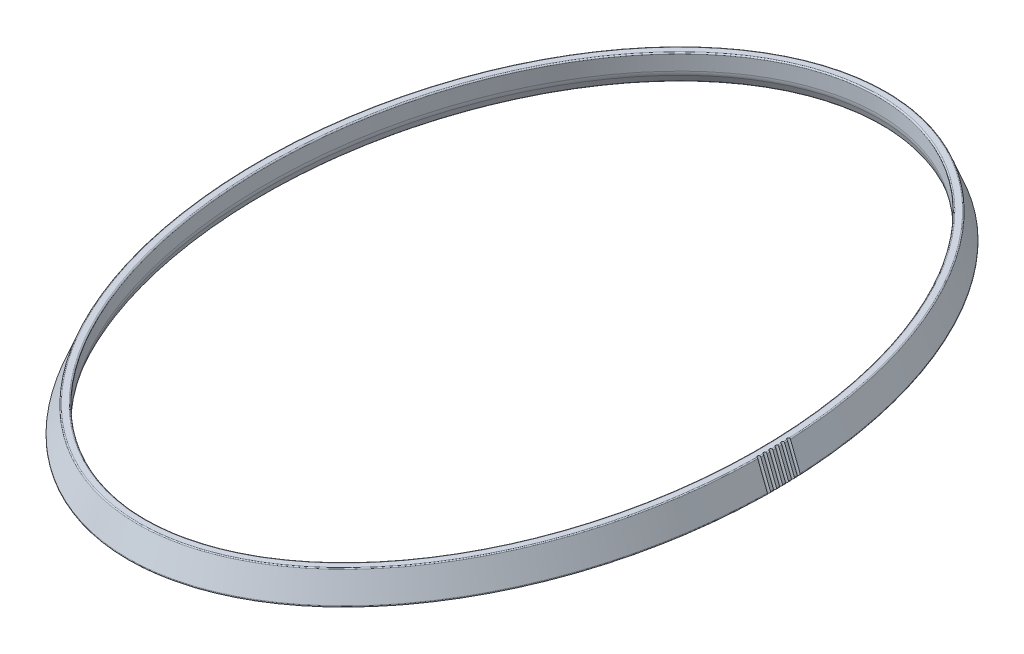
SolidWorks part; units mm, degrees
ref_plane "Front Plane" through (0, 0, 0) normal (0, 0, 1) x (1, 0, 0)
ref_plane "Top Plane" through (0, 0, 0) normal (0, 1, 0) x (1, 0, 0)
ref_plane "Right Plane" through (0, 0, 0) normal (1, 0, 0) x (0, 0, -1)
sketch "Sketch2" plane through (0, 0, 0) normal (0, 1, 0) x (1, 0, 0)
  line L0 (0, 60) -> (0, 0) construction
  ellipse E0 centre (0, 0) end of major axis (0, 60) minor radius 40 construction
  point P1 (0, 60.6)
  dimension "D2" = 80
  dimension "D1" = 120
  dimension "D3" = 0.6
sketch "Sketch4" plane through (0, 0, 0) normal (1, 0, 0) x (0, 0, -1)
  line L0 (60.6, 0) -> (60.6, -3)
  line L1 (60.6, -3) -> (61.146, -4.5)
  line L2 (61.146, -4.5) -> (63.6, -4.5)
  line L3 (63.6, -4.5) -> (61.85, 0)
  line L4 (61.85, 0) -> (60.6, 0)
  dimension "D1" = 1.25
  dimension "D2" = 3
  dimension "D3" = 4.5
  dimension "D4" = 20
  dimension "D5" = 3
sweep "Sweep1" add profiles "Sketch4" path "Sketch2"
sketch "Sketch9" plane through (0, 0, 0) normal (0, 0, 1) x (1, 0, 0)
  line L0 (43.6, -4.5) -> (41.85, 0) construction
  line L1 (43.6, -4.5) -> (41.85, 0)
fillet "Fillet1" radius 2 1 edges
fillet "Fillet2" radius 0.2 4 edges
ref_plane "Plane2" through (41.85, 0, 0) normal (-0.3624, 0.932, 0) x (0.932, 0.3624, 0)
sketch "Sketch13" plane through (41.85, 0, 0) normal (-0.3624, 0.932, 0) x (0.932, 0.3624, 0)
  circle A0 centre (0, 0) radius 0.25
  circle A1 centre (-0.0051, 1) radius 0.25
  circle A2 centre (-0.0051, -1) radius 0.25
  circle A4 centre (-0.0204, 1.9999) radius 0.25
  circle A5 centre (-0.0458, 2.9995) radius 0.25
  circle A6 centre (-0.0816, 3.9995) radius 0.25
  spline S0 degree 3 number of poles 146 (-39.0506, 61.8996) -> (-39.0506, 61.8996) construction
  spline S1 degree 3 number of poles 146 (-39.0506, 61.8996) -> (-39.0506, 61.8996) construction
  dimension "D1" = 0.5
  dimension "D2" = 0.5
  dimension "D6" = 1
  dimension "D7" = 0.5
  dimension "D9" = 0.5
  dimension "D3" = 1
  dimension "D4" = 1
  dimension "D5" = 1
  dimension "D8" = 1
extrude "Cut-Extrude1" cut sketch "Sketch13" against normal through all both and the other way through all contours A4 | A1 | A0 | A5 | A6 | A2
